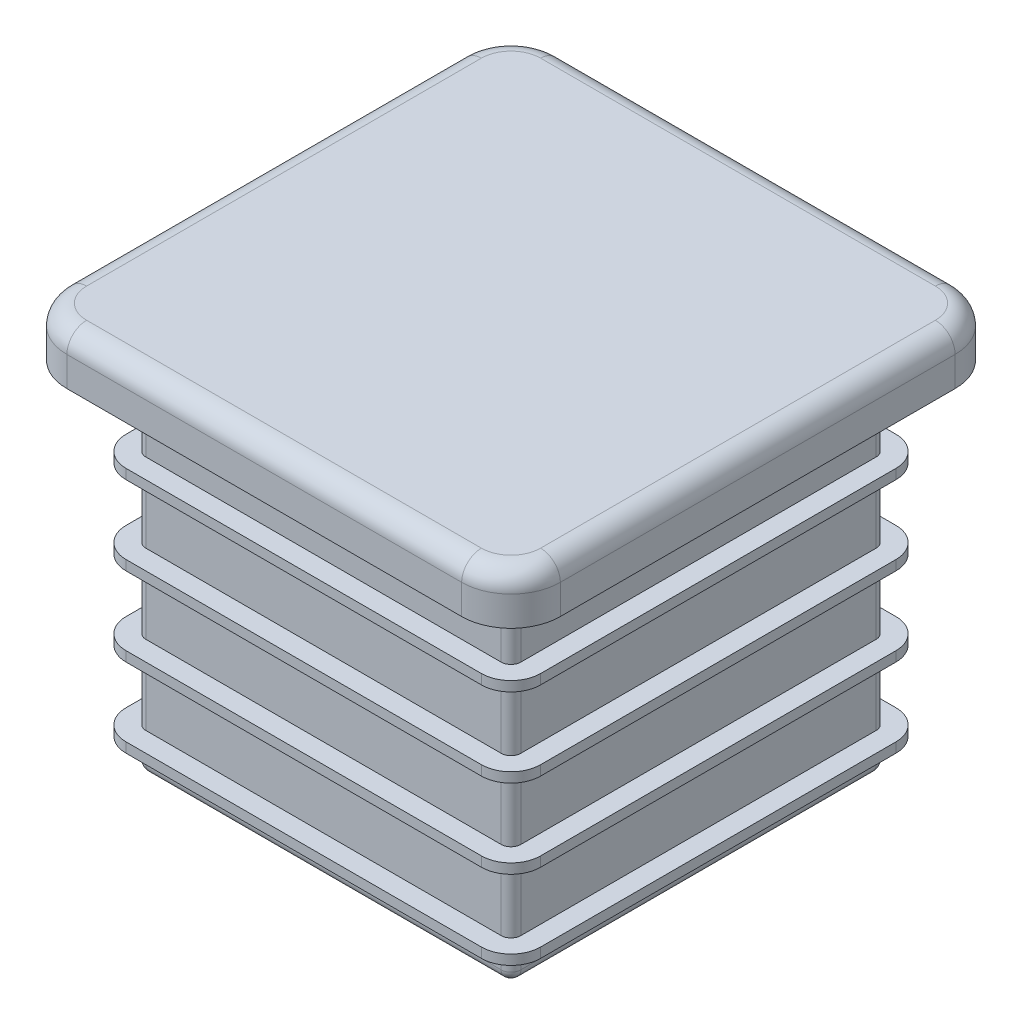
SolidWorks part; units mm, degrees
ref_plane "Plan de face" through (0, 0, 0) normal (0, 0, 1) x (1, 0, 0)
ref_plane "Plan de dessus" through (0, 0, 0) normal (0, 1, 0) x (1, 0, 0)
ref_plane "Plan de droite" through (0, 0, 0) normal (1, 0, 0) x (0, 0, -1)
sketch "Esquisse1" plane through (0, 0, 0) normal (0, 1, 0) x (1, 0, 0)
  line L1 (-10, 12.5) -> (10, 12.5)
  line L2 (-12.5, 10) -> (-12.5, -10)
  line L3 (-10, -12.5) -> (10, -12.5)
  line L4 (12.5, 10) -> (12.5, -10)
  line L5 (-12.5, 12.5) -> (12.5, -12.5) construction
  line L6 (-12.5, -12.5) -> (12.5, 12.5) construction
  arc A0 (-12.5, -10) -> (-10, -12.5) centre (-10, -10) ccw
  arc A1 (10, -12.5) -> (12.5, -10) centre (10, -10) ccw
  arc A2 (10, 12.5) -> (12.5, 10) centre (10, 10) cw
  arc A3 (-10, 12.5) -> (-12.5, 10) centre (-10, 10) ccw
  point P0 (0, 0)
  dimension "D2" = 2.5
  dimension "D1" = 25
extrude "Boss.-Extru.1" add sketch "Esquisse1" along normal blind 2.5
fillet "Congé1" radius 1 8 edges at (-11.7678, 2.5, 11.7678) (-12.5, 2.5, 0) (-11.7678, 2.5, -11.7678) (0, 2.5, -12.5) (11.7678, 2.5, -11.7678) (12.5, 2.5, 0) (11.7678, 2.5, 11.7678) (0, 2.5, 12.5)
sketch "Esquisse2" plane through (0, 0, 0) normal (0, -1, 0) x (1, 0, 0)
  line L1 (-9.5, 9.5) -> (9.5, 9.5)
  line L2 (-9.5, 9.5) -> (-9.5, -9.5)
  line L3 (-9.5, -9.5) -> (9.5, -9.5)
  line L4 (9.5, 9.5) -> (9.5, -9.5)
  line L5 (-9.5, 9.5) -> (9.5, -9.5) construction
  line L6 (-9.5, -9.5) -> (9.5, 9.5) construction
  point P0 (0, 0)
  dimension "D1" = 19
extrude "Extru.-Mince1" add sketch "Esquisse2" along normal blind 18 thin
fillet "Congé2" radius 0.5 4 edges at (-9.5, -9, 9.5) (-9.5, -9, -9.5) (9.5, -9, 9.5) (9.5, -9, -9.5)
fillet "Congé3" radius 0.5 8 edges at (-9.3536, -18, 9.3536) (0, -18, 9.5) (9.3536, -18, 9.3536) (9.5, -18, 0) (9.3536, -18, -9.3536) (0, -18, -9.5) (-9.3536, -18, -9.3536) (-9.5, -18, 0)
ref_plane "Plan1" through (0, -4, 0) normal (0, -1, 0) x (-1, 0, 0)
sketch "Esquisse3" plane through (0, -4, 0) normal (0, -1, 0) x (-1, 0, 0)
  line L0 (9.5, -9) -> (9.5, 9) construction
  line L1 (-9, -9.5) -> (9, -9.5) construction
  line L2 (-9.5, 9) -> (-9.5, -9) construction
  line L3 (9, 9.5) -> (-9, 9.5) construction
  line L4 (9.5, -9) -> (9.5, 9)
  line L5 (-9, -9.5) -> (9, -9.5)
  line L6 (-9.5, 9) -> (-9.5, -9)
  line L7 (9, 9.5) -> (-9, 9.5)
  line L8 (10.5, -9) -> (10.5, 9)
  line L9 (9, 10.5) -> (-9, 10.5)
  line L10 (-10.5, 9) -> (-10.5, -9)
  line L11 (-9, -10.5) -> (9, -10.5)
  arc A0 (9, -9.5) -> (9.5, -9) centre (9, -9) ccw construction
  arc A1 (-9.5, -9) -> (-9, -9.5) centre (-9, -9) ccw construction
  arc A2 (-9, 9.5) -> (-9.5, 9) centre (-9, 9) ccw construction
  arc A3 (9.5, 9) -> (9, 9.5) centre (9, 9) ccw construction
  arc A4 (9, -9.5) -> (9.5, -9) centre (9, -9) ccw
  arc A5 (-9.5, -9) -> (-9, -9.5) centre (-9, -9) ccw
  arc A6 (-9, 9.5) -> (-9.5, 9) centre (-9, 9) ccw
  arc A7 (9.5, 9) -> (9, 9.5) centre (9, 9) ccw
  arc A8 (10.5, 9) -> (9, 10.5) centre (9, 9) ccw
  arc A9 (-9, 10.5) -> (-10.5, 9) centre (-9, 9) ccw
  arc A10 (-10.5, -9) -> (-9, -10.5) centre (-9, -9) ccw
  arc A11 (9, -10.5) -> (10.5, -9) centre (9, -9) ccw
  dimension "D1" = 1
extrude "Boss.-Extru.2" add sketch "Esquisse3" along normal blind 0.5
pattern_linear "Répétition linéaire1" count 4 spacing 4 along (0, -1, 0) of "Boss.-Extru.2"
